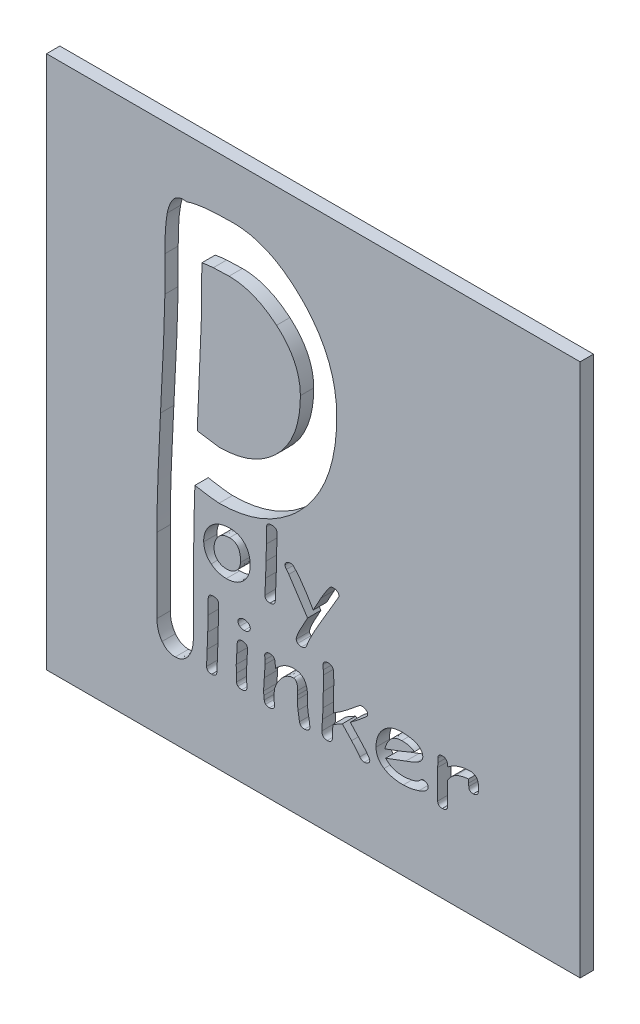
SolidWorks part; units mm, degrees
ref_plane "Front Plane" through (0, 0, 0) normal (0, 0, 1) x (1, 0, 0)
ref_plane "Top Plane" through (0, 0, 0) normal (0, 1, 0) x (1, 0, 0)
ref_plane "Right Plane" through (0, 0, 0) normal (1, 0, 0) x (0, 0, -1)
imported_body "Blank.step"
sketch "Sketch4" plane through (0, 0, 22.1266) normal (0, 0, 1) x (1, 0, 0)
  line L25 (-11.1986, 9.2463) -> (-11.5113, 1.6728)
  line L26 (-2.8189, -5.6212) -> (-2.2368, -4.5509)
  line L27 (-0.0405, -11.5136) -> (0.8168, -12.435)
  line L28 (-14.5347, -12.0279) -> (-14.5347, -6.4334)
  line L29 (6.5117, -13.3502) -> (6.5117, -11.1723)
  line L30 (-5.6686, -10.4712) -> (-5.6568, -10.8342)
  line L31 (4.1166, -11.9572) -> (2.6142, -12.5188)
  line L32 (-11.5113, 1.6728) -> (-9.8731, 1.4255)
  line L33 (-0.9429, -3.8807) -> (-2.3037, -6.2014)
  line L34 (-0.2805, -10.8373) -> (0.5848, -10.133)
  line L35 (-9.9516, -11.0172) -> (-10.0106, -12.5591)
  line L36 (-3.0745, -7.6192) -> (-3.3341, -8.221)
  line L37 (-11.1688, 12.7475) -> (-11.1986, 9.2463)
  line L38 (-3.238, -11.7525) -> (-3.242, -12.041)
  line L39 (-5.5759, -4.2096) -> (-5.6349, -5.7515)
  line L40 (0.0578, -12.6615) -> (-0.6384, -11.9138)
  line L41 (8.8283, -11.0265) -> (8.8165, -10.7659)
  line L42 (2.5473, -11.9479) -> (3.7548, -11.495)
  line L43 (-13.9389, 9.3224) -> (-13.9389, 11.9483)
  line L44 (-4.6516, -4.2127) -> (-4.8286, -3.9862)
  line L45 (-3.8476, -13.3844) -> (-3.9578, -12.7049)
  line L46 (-3.2436, -6.3503) -> (-4.6516, -4.2127)
  line L47 (-3.238, -11.4391) -> (-3.238, -11.7525)
  line L48 (-1.2716, -9.466) -> (-1.2991, -10.465)
  line L49 (7.2393, -11.6501) -> (7.2472, -13.3502)
  spline S194 degree 3 poles (-11.8092, -12.0279) (-11.8092, -12.5353) (-11.9383, -12.9666) (-12.1964, -13.3218) knots 0 0 0 0 1 1 1 1
  spline S195 degree 3 poles (-1.0563, 7.8191) (-1.0563, 4.673) (-1.9896, 2.1676) (-3.8562, 0.3028) knots 0 0 0 0 1 1 1 1
  spline S196 degree 3 poles (-3.7818, 7.8191) (-3.7818, 9.2399) (-4.3775, 10.4641) (-5.5689, 11.4916) knots 0 0 0 0 1 1 1 1
  spline S197 degree 3 poles (-6.331, -3.0896) (-6.3179, -2.6677) (-6.3113, -2.2933) (-6.3113, -1.9665) knots 0 0 0 0 1 1 1 1
  spline S198 degree 3 poles (-10.4275, -13.5891) (-10.6844, -13.5891) (-10.8129, -13.4836) (-10.8129, -13.2727) knots 0 0 0 0 1 1 1 1
  spline S199 degree 3 poles (-9.9122, -8.7741) (-9.9122, -9.1009) (-9.9188, -9.4753) (-9.9319, -9.8972) knots 0 0 0 0 1 1 1 1
  spline S200 degree 3 poles (-7.8081, -12.6056) (-7.7976, -12.8518) (-7.7924, -13.0369) (-7.7924, -13.161) knots 0 0 0 0 1 1 1 1
  spline S201 degree 3 poles (-8.5121, -10.5922) (-8.5121, -10.4991) (-8.4767, -10.4236) (-8.4059, -10.3657) knots 0 0 0 0 1 1 1 1
  spline S202 degree 3 poles (-2.1289, -12.373) (-2.0975, -12.0296) (-2.0817, -11.7721) (-2.0817, -11.6005) knots 0 0 0 0 1 1 1 1
  spline S203 degree 3 poles (-2.066, -10.5239) (-2.0529, -10.1185) (-2.0463, -9.7607) (-2.0463, -9.4505) knots 0 0 0 0 1 1 1 1
  spline S204 degree 3 poles (-1.2912, -9.1309) (-1.2781, -9.2592) (-1.2716, -9.3708) (-1.2716, -9.466) knots 0 0 0 0 1 1 1 1
  spline S205 degree 3 poles (0.8168, -12.435) (1.218, -12.8673) (1.4186, -13.1486) (1.4186, -13.2789) knots 0 0 0 0 1 1 1 1
  spline S206 degree 3 poles (-4.0932, -8.1466) (-4.0932, -7.9397) (-3.81, -7.341) (-3.2436, -6.3503) knots 0 0 0 0 1 1 1 1
  spline S207 degree 3 poles (-10.7067, -9.8972) (-10.6936, -9.4753) (-10.687, -9.1009) (-10.687, -8.7741) knots 0 0 0 0 1 1 1 1
  spline S208 degree 3 poles (-8.4571, -13.3844) (-8.5278, -13.3264) (-8.5632, -13.252) (-8.5632, -13.161) knots 0 0 0 0 1 1 1 1
  spline S209 degree 3 poles (-3.9853, -11.436) (-3.9853, -10.9893) (-4.0902, -10.7659) (-4.2999, -10.7659) knots 0 0 0 0 1 1 1 1
  spline S210 degree 3 poles (-6.3451, -10.1547) (-6.269, -10.0968) (-6.1759, -10.0679) (-6.0658, -10.0679) knots 0 0 0 0 1 1 1 1
  spline S211 degree 3 poles (-1.3895, -13.251) (-1.3895, -13.344) (-1.4263, -13.4195) (-1.4997, -13.4774) knots 0 0 0 0 1 1 1 1
  spline S212 degree 3 poles (0.864, -10.0275) (0.9663, -10.0275) (1.0581, -10.0596) (1.1393, -10.1237) knots 0 0 0 0 1 1 1 1
  spline S213 degree 3 poles (3.8216, -10.7721) (3.5017, -10.7721) (3.2356, -10.8704) (3.0232, -11.0668) knots 0 0 0 0 1 1 1 1
  spline S214 degree 3 poles (9.1783, -11.5508) (8.9528, -11.5508) (8.8401, -11.4484) (8.8401, -11.2437) knots 0 0 0 0 1 1 1 1
  spline S215 degree 3 poles (-9.8731, -2.209) (-10.1511, -2.209) (-10.7568, -2.1266) (-11.6901, -1.9617) knots 0 0 0 0 1 1 1 1
  spline S216 degree 3 poles (-14.2666, 1.4445) (-14.068, 5.1107) (-13.9588, 7.7366) (-13.9389, 9.3224) knots 0 0 0 0 1 1 1 1
  spline S217 degree 3 poles (-11.0269, -5.2954) (-11.0427, -4.828) (-10.8932, -4.4164) (-10.5786, -4.0607) knots 0 0 0 0 1 1 1 1
  spline S218 degree 3 poles (-9.0447, -3.4309) (-8.5204, -3.4309) (-8.1231, -3.6201) (-7.8531, -3.9986) knots 0 0 0 0 1 1 1 1
  spline S219 degree 3 poles (-9.9965, -4.495) (-10.1669, -4.7287) (-10.2522, -4.9955) (-10.2522, -5.2954) knots 0 0 0 0 1 1 1 1
  spline S220 degree 3 poles (-5.6349, -5.7515) (-5.6349, -5.9149) (-5.6454, -6.1548) (-5.6663, -6.4713) knots 0 0 0 0 1 1 1 1
  spline S221 degree 3 poles (-2.3037, -6.2014) (-2.6393, -6.766) (-2.8962, -7.2386) (-3.0745, -7.6192) knots 0 0 0 0 1 1 1 1
  spline S222 degree 3 poles (-10.0106, -12.5591) (-10.0106, -12.7225) (-10.0211, -12.9624) (-10.042, -13.2789) knots 0 0 0 0 1 1 1 1
  spline S223 degree 3 poles (-8.461, -9.1682) (-8.461, -9.0689) (-8.4151, -8.9841) (-8.3233, -8.9138) knots 0 0 0 0 1 1 1 1
  spline S224 degree 3 poles (-7.7413, -10.5922) (-7.7413, -10.7866) (-7.7544, -11.0296) (-7.7806, -11.3212) knots 0 0 0 0 1 1 1 1
  spline S225 degree 3 poles (-3.1594, -12.708) (-3.1017, -12.979) (-3.0728, -13.1992) (-3.0728, -13.3688) knots 0 0 0 0 1 1 1 1
  spline S226 degree 3 poles (-0.6384, -11.9138) (-0.7904, -12.0089) (-1.0264, -12.1424) (-1.3463, -12.314) knots 0 0 0 0 1 1 1 1
  spline S227 degree 3 poles (4.8874, -10.3874) (5.2257, -10.5301) (5.3948, -10.7494) (5.3948, -11.0451) knots 0 0 0 0 1 1 1 1
  spline S228 degree 3 poles (5.4499, -12.5219) (5.5416, -12.5219) (5.6229, -12.5498) (5.6937, -12.6056) knots 0 0 0 0 1 1 1 1
  spline S229 degree 3 poles (7.8214, -11.042) (7.5881, -11.1765) (7.394, -11.3792) (7.2393, -11.6501) knots 0 0 0 0 1 1 1 1
  spline S230 degree 3 poles (6.8775, -10.2447) (7.1345, -10.2447) (7.2643, -10.4164) (7.2669, -10.7597) knots 0 0 0 0 1 1 1 1
  spline S231 degree 3 poles (-14.5347, -6.4334) (-14.5347, -4.5686) (-14.4453, -1.9426) (-14.2666, 1.4445) knots 0 0 0 0 1 1 1 1
  spline S232 degree 3 poles (-9.1284, 12.8998) (-9.5653, 12.8998) (-9.9575, 12.8871) (-10.305, 12.8617) knots 0 0 0 0 1 1 1 1
  spline S233 degree 3 poles (-6.0518, -6.7815) (-6.3087, -6.7815) (-6.4372, -6.676) (-6.4372, -6.4651) knots 0 0 0 0 1 1 1 1
  spline S234 degree 3 poles (-6.4372, -6.4651) (-6.4372, -6.2148) (-6.4228, -5.8394) (-6.3939, -5.3389) knots 0 0 0 0 1 1 1 1
  spline S235 degree 3 poles (-3.9752, -8.3575) (-4.0538, -8.3017) (-4.0932, -8.2314) (-4.0932, -8.1466) knots 0 0 0 0 1 1 1 1
  spline S236 degree 3 poles (-4.9348, -3.7473) (-4.9348, -3.6625) (-4.8942, -3.5881) (-4.8129, -3.524) knots 0 0 0 0 1 1 1 1
  spline S237 degree 3 poles (-7.7806, -11.3212) (-7.8068, -11.6108) (-7.8199, -11.8528) (-7.8199, -12.0472) knots 0 0 0 0 1 1 1 1
  spline S238 degree 3 poles (-3.9578, -12.7049) (-3.9945, -12.4629) (-4.0128, -12.2365) (-4.0128, -12.0255) knots 0 0 0 0 1 1 1 1
  spline S239 degree 3 poles (-6.4866, -11.8487) (-6.4473, -11.4702) (-6.4277, -11.1744) (-6.4277, -10.9614) knots 0 0 0 0 1 1 1 1
  spline S240 degree 3 poles (-2.0463, -9.4505) (-2.0463, -9.3574) (-2.0529, -9.2478) (-2.066, -9.1216) knots 0 0 0 0 1 1 1 1
  spline S241 degree 3 poles (2.6142, -12.5188) (2.761, -12.6904) (2.9433, -12.8197) (3.1609, -12.9066) knots 0 0 0 0 1 1 1 1
  spline S242 degree 3 poles (5.1627, -12.6894) (5.2519, -12.5777) (5.3476, -12.5219) (5.4499, -12.5219) knots 0 0 0 0 1 1 1 1
  spline S243 degree 3 poles (-13.9389, 11.9483) (-13.9389, 13.2042) (-13.8794, 14.1176) (-13.7602, 14.6885) knots 0 0 0 0 1 1 1 1
  spline S244 degree 3 poles (-5.5689, 11.4916) (-6.671, 12.4304) (-7.8575, 12.8998) (-9.1284, 12.8998) knots 0 0 0 0 1 1 1 1
  spline S245 degree 3 poles (-7.9969, -9.528) (-8.1228, -9.528) (-8.2316, -9.4929) (-8.3233, -9.4226) knots 0 0 0 0 1 1 1 1
  spline S246 degree 3 poles (-7.9969, -8.8083) (-7.871, -8.8083) (-7.7635, -8.8434) (-7.6744, -8.9138) knots 0 0 0 0 1 1 1 1
  spline S247 degree 3 poles (-8.5632, -13.161) (-8.5632, -13.0369) (-8.5685, -12.8518) (-8.579, -12.6056) knots 0 0 0 0 1 1 1 1
  spline S248 degree 3 poles (-8.1267, -10.2788) (-8.0139, -10.2788) (-7.9222, -10.3078) (-7.8514, -10.3657) knots 0 0 0 0 1 1 1 1
  spline S249 degree 3 poles (-6.4434, -10.6666) (-6.4513, -10.5363) (-6.4552, -10.4381) (-6.4552, -10.3719) knots 0 0 0 0 1 1 1 1
  spline S250 degree 3 poles (2.3822, -10.8093) (2.7414, -10.4122) (3.2212, -10.2137) (3.8216, -10.2137) knots 0 0 0 0 1 1 1 1
  spline S251 degree 3 poles (5.6937, -12.6056) (5.7671, -12.6594) (5.8038, -12.7225) (5.8038, -12.7949) knots 0 0 0 0 1 1 1 1
  spline S252 degree 3 poles (8.9423, -10.1858) (9.1547, -10.1858) (9.3133, -10.2488) (9.4182, -10.375) knots 0 0 0 0 1 1 1 1
  spline S253 degree 3 poles (9.4182, -10.375) (9.5231, -10.5012) (9.5755, -10.6914) (9.5755, -10.9458) knots 0 0 0 0 1 1 1 1
  spline S254 degree 3 poles (-9.8731, 1.4255) (-8.205, 1.4255) (-6.8001, 1.9646) (-5.6583, 3.0429) knots 0 0 0 0 1 1 1 1
  spline S255 degree 3 poles (-9.3318, -6.8311) (-9.7723, -6.8311) (-10.1512, -6.7029) (-10.4685, -6.4464) knots 0 0 0 0 1 1 1 1
  spline S256 degree 3 poles (-10.2522, -5.2954) (-10.2522, -5.5953) (-10.1486, -5.8291) (-9.9415, -5.9966) knots 0 0 0 0 1 1 1 1
  spline S257 degree 3 poles (-5.9259, -1.6563) (-5.6663, -1.6563) (-5.5366, -1.7597) (-5.5366, -1.9665) knots 0 0 0 0 1 1 1 1
  spline S258 degree 3 poles (-3.6881, -8.4444) (-3.7982, -8.4444) (-3.8939, -8.4155) (-3.9752, -8.3575) knots 0 0 0 0 1 1 1 1
  spline S259 degree 3 poles (-10.7696, -12.1465) (-10.7408, -11.6439) (-10.7264, -11.2675) (-10.7264, -11.0172) knots 0 0 0 0 1 1 1 1
  spline S260 degree 3 poles (-7.8199, -12.0472) (-7.8199, -12.1713) (-7.816, -12.3575) (-7.8081, -12.6056) knots 0 0 0 0 1 1 1 1
  spline S261 degree 3 poles (-5.1416, -11.1785) (-5.3828, -11.4288) (-5.5716, -11.7452) (-5.7079, -12.1279) knots 0 0 0 0 1 1 1 1
  spline S262 degree 3 poles (-2.0817, -11.6005) (-2.0817, -11.2861) (-2.0765, -10.9272) (-2.066, -10.5239) knots 0 0 0 0 1 1 1 1
  spline S263 degree 3 poles (-2.066, -9.1216) (-2.0765, -8.9955) (-2.0817, -8.8858) (-2.0817, -8.7928) knots 0 0 0 0 1 1 1 1
  spline S264 degree 3 poles (-1.3109, -8.7928) (-1.3109, -8.8879) (-1.3043, -9.0006) (-1.2912, -9.1309) knots 0 0 0 0 1 1 1 1
  spline S265 degree 3 poles (-1.3109, -11.5446) (-0.9543, -11.3295) (-0.6108, -11.0937) (-0.2805, -10.8373) knots 0 0 0 0 1 1 1 1
  spline S266 degree 3 poles (9.5755, -10.9458) (9.5755, -11.0534) (9.5742, -11.1258) (9.5716, -11.163) knots 0 0 0 0 1 1 1 1
  spline S267 degree 3 poles (-5.6663, -6.4713) (-5.6926, -6.6781) (-5.821, -6.7815) (-6.0518, -6.7815) knots 0 0 0 0 1 1 1 1
  spline S268 degree 3 poles (-4.8129, -3.524) (-4.729, -3.4598) (-4.6359, -3.4278) (-4.5337, -3.4278) knots 0 0 0 0 1 1 1 1
  spline S269 degree 3 poles (-10.3016, -8.4639) (-10.042, -8.4639) (-9.9122, -8.5673) (-9.9122, -8.7741) knots 0 0 0 0 1 1 1 1
  spline S270 degree 3 poles (-8.5514, -11.3212) (-8.5252, -11.0296) (-8.5121, -10.7866) (-8.5121, -10.5922) knots 0 0 0 0 1 1 1 1
  spline S271 degree 3 poles (-5.8298, -13.5178) (-5.9006, -13.5757) (-5.9924, -13.6046) (-6.1052, -13.6046) knots 0 0 0 0 1 1 1 1
  spline S272 degree 3 poles (-3.0728, -13.3688) (-3.0728, -13.4598) (-3.1109, -13.5333) (-3.1869, -13.5891) knots 0 0 0 0 1 1 1 1
  spline S273 degree 3 poles (1.0096, -13.5829) (0.8653, -13.5829) (0.7539, -13.5229) (0.6753, -13.403) knots 0 0 0 0 1 1 1 1
  spline S274 degree 3 poles (1.4186, -13.2789) (1.4186, -13.3616) (1.3766, -13.433) (1.2927, -13.4929) knots 0 0 0 0 1 1 1 1
  spline S275 degree 3 poles (3.0232, -11.0668) (2.8108, -11.2613) (2.6522, -11.555) (2.5473, -11.9479) knots 0 0 0 0 1 1 1 1
  spline S276 degree 3 poles (6.8578, -13.6636) (6.6271, -13.6636) (6.5117, -13.5591) (6.5117, -13.3502) knots 0 0 0 0 1 1 1 1
  spline S277 degree 3 poles (-13.7602, 14.6885) (-13.5319, 15.8048) (-13.0453, 16.2869) (-12.3007, 16.1346) knots 0 0 0 0 1 1 1 1
  spline S278 degree 3 poles (-8.7859, 16.5152) (-6.9689, 16.5152) (-5.2661, 15.7224) (-3.6775, 14.1366) knots 0 0 0 0 1 1 1 1
  spline S279 degree 3 poles (-6.3939, -5.3389) (-6.3651, -4.8363) (-6.3507, -4.4599) (-6.3507, -4.2096) knots 0 0 0 0 1 1 1 1
  spline S280 degree 3 poles (-10.042, -13.2789) (-10.0683, -13.4857) (-10.1967, -13.5891) (-10.4275, -13.5891) knots 0 0 0 0 1 1 1 1
  spline S281 degree 3 poles (-8.3233, -8.9138) (-8.2316, -8.8434) (-8.1228, -8.8083) (-7.9969, -8.8083) knots 0 0 0 0 1 1 1 1
  spline S282 degree 3 poles (-4.001, -11.7308) (-3.9905, -11.5922) (-3.9853, -11.4939) (-3.9853, -11.436) knots 0 0 0 0 1 1 1 1
  spline S283 degree 3 poles (-2.1722, -13.1424) (-2.1722, -12.9707) (-2.1578, -12.7142) (-2.1289, -12.373) knots 0 0 0 0 1 1 1 1
  spline S284 degree 3 poles (-2.0817, -8.7928) (-2.0817, -8.6997) (-2.0463, -8.6242) (-1.9756, -8.5663) knots 0 0 0 0 1 1 1 1
  spline S285 degree 3 poles (-1.2991, -10.465) (-1.3122, -10.8249) (-1.3161, -11.1847) (-1.3109, -11.5446) knots 0 0 0 0 1 1 1 1
  spline S286 degree 3 poles (4.9504, -11.6098) (4.8193, -11.6842) (4.5413, -11.8001) (4.1166, -11.9572) knots 0 0 0 0 1 1 1 1
  spline S287 degree 3 poles (3.7548, -11.495) (4.2293, -11.313) (4.5676, -11.1547) (4.7695, -11.0203) knots 0 0 0 0 1 1 1 1
  spline S288 degree 3 poles (-11.6901, -1.9617) (-11.7695, -3.8772) (-11.8092, -7.2326) (-11.8092, -12.0279) knots 0 0 0 0 1 1 1 1
  spline S289 degree 3 poles (-4.2544, -3.5364) (-3.8087, -4.0245) (-3.3302, -4.7194) (-2.8189, -5.6212) knots 0 0 0 0 1 1 1 1
  spline S290 degree 3 poles (-2.2368, -4.5509) (-2.0271, -4.1806) (-1.8252, -3.8621) (-1.6311, -3.5953) knots 0 0 0 0 1 1 1 1
  spline S291 degree 3 poles (-8.579, -12.6056) (-8.5868, -12.3575) (-8.5908, -12.1713) (-8.5908, -12.0472) knots 0 0 0 0 1 1 1 1
  spline S292 degree 3 poles (-4.0128, -12.0255) (-4.0128, -11.9676) (-4.0089, -11.8693) (-4.001, -11.7308) knots 0 0 0 0 1 1 1 1
  spline S293 degree 3 poles (-6.5417, -12.7328) (-6.5417, -12.5198) (-6.5234, -12.2251) (-6.4866, -11.8487) knots 0 0 0 0 1 1 1 1
  spline S294 degree 3 poles (-6.4277, -10.9614) (-6.4277, -10.8952) (-6.4329, -10.7969) (-6.4434, -10.6666) knots 0 0 0 0 1 1 1 1
  spline S295 degree 3 poles (3.1609, -12.9066) (3.3811, -12.9935) (3.6368, -13.0369) (3.9278, -13.0369) knots 0 0 0 0 1 1 1 1
  spline S296 degree 3 poles (5.8038, -12.7949) (5.8038, -13.0245) (5.5692, -13.222) (5.0998, -13.3875) knots 0 0 0 0 1 1 1 1
  spline S297 degree 3 poles (6.5196, -10.8652) (6.5275, -10.7287) (6.5314, -10.6263) (6.5314, -10.558) knots 0 0 0 0 1 1 1 1
  spline S298 degree 3 poles (-13.1645, -13.8356) (-13.5616, -13.8356) (-13.8893, -13.6643) (-14.1474, -13.3218) knots 0 0 0 0 1 1 1 1
  spline S299 degree 3 poles (-12.3007, 16.1346) (-11.983, 16.2615) (-11.5312, 16.3567) (-10.9454, 16.4201) knots 0 0 0 0 1 1 1 1
  spline S300 degree 3 poles (-10.4685, -6.4464) (-10.8224, -6.161) (-11.0086, -5.7774) (-11.0269, -5.2954) knots 0 0 0 0 1 1 1 1
  spline S301 degree 3 poles (-7.8531, -3.9986) (-7.6381, -4.3047) (-7.5345, -4.6729) (-7.5424, -5.1031) knots 0 0 0 0 1 1 1 1
  spline S302 degree 3 poles (-7.9986, -6.2789) (-8.3342, -6.6471) (-8.7786, -6.8311) (-9.3318, -6.8311) knots 0 0 0 0 1 1 1 1
  spline S303 degree 3 poles (-8.6279, -5.9687) (-8.405, -5.7949) (-8.287, -5.5602) (-8.2739, -5.2644) knots 0 0 0 0 1 1 1 1
  spline S304 degree 3 poles (-8.2739, -5.2644) (-8.2372, -4.464) (-8.5112, -4.0627) (-9.0959, -4.0607) knots 0 0 0 0 1 1 1 1
  spline S305 degree 3 poles (-9.9319, -9.8972) (-9.945, -10.3171) (-9.9516, -10.6904) (-9.9516, -11.0172) knots 0 0 0 0 1 1 1 1
  spline S306 degree 3 poles (-7.6744, -8.9138) (-7.5826, -8.9841) (-7.5367, -9.0689) (-7.5367, -9.1682) knots 0 0 0 0 1 1 1 1
  spline S307 degree 3 poles (-8.4059, -10.3657) (-8.3325, -10.3078) (-8.2394, -10.2788) (-8.1267, -10.2788) knots 0 0 0 0 1 1 1 1
  spline S308 degree 3 poles (-5.7433, -13.0121) (-5.7276, -13.1362) (-5.7197, -13.2292) (-5.7197, -13.2913) knots 0 0 0 0 1 1 1 1
  spline S309 degree 3 poles (-5.6568, -10.8342) (-5.2163, -10.3709) (-4.764, -10.1392) (-4.2999, -10.1392) knots 0 0 0 0 1 1 1 1
  spline S310 degree 3 poles (-1.9756, -8.5663) (-1.9021, -8.5084) (-1.8091, -8.4794) (-1.6963, -8.4794) knots 0 0 0 0 1 1 1 1
  spline S311 degree 3 poles (-1.6963, -8.4794) (-1.5836, -8.4794) (-1.4918, -8.5084) (-1.421, -8.5663) knots 0 0 0 0 1 1 1 1
  spline S312 degree 3 poles (8.8401, -11.2437) (8.8401, -11.2044) (8.8361, -11.132) (8.8283, -11.0265) knots 0 0 0 0 1 1 1 1
  spline S313 degree 3 poles (8.8165, -10.7659) (8.4022, -10.8052) (8.0705, -10.8972) (7.8214, -11.042) knots 0 0 0 0 1 1 1 1
  spline S314 degree 3 poles (-12.1964, -13.3218) (-12.4546, -13.6643) (-12.7773, -13.8356) (-13.1645, -13.8356) knots 0 0 0 0 1 1 1 1
  spline S315 degree 3 poles (-9.9415, -5.9966) (-9.7684, -6.1352) (-9.5652, -6.2045) (-9.3318, -6.2045) knots 0 0 0 0 1 1 1 1
  spline S316 degree 3 poles (-1.3008, -3.4216) (-1.1933, -3.4216) (-1.0989, -3.4516) (-1.0176, -3.5115) knots 0 0 0 0 1 1 1 1
  spline S317 degree 3 poles (-10.8129, -13.2727) (-10.8129, -13.0224) (-10.7985, -12.647) (-10.7696, -12.1465) knots 0 0 0 0 1 1 1 1
  spline S318 degree 3 poles (-7.7924, -13.161) (-7.7924, -13.252) (-7.8278, -13.3264) (-7.8986, -13.3844) knots 0 0 0 0 1 1 1 1
  spline S319 degree 3 poles (-3.4661, -13.676) (-3.6916, -13.676) (-3.8188, -13.5788) (-3.8476, -13.3844) knots 0 0 0 0 1 1 1 1
  spline S320 degree 3 poles (-6.5181, -13.0121) (-6.5338, -12.888) (-6.5417, -12.7949) (-6.5417, -12.7328) knots 0 0 0 0 1 1 1 1
  spline S321 degree 3 poles (-6.4552, -10.3719) (-6.4552, -10.283) (-6.4185, -10.2106) (-6.3451, -10.1547) knots 0 0 0 0 1 1 1 1
  spline S322 degree 3 poles (1.1511, -10.5549) (0.8286, -10.8528) (0.4314, -11.1723) (-0.0405, -11.5136) knots 0 0 0 0 1 1 1 1
  spline S323 degree 3 poles (1.2927, -13.4929) (1.2114, -13.5529) (1.1171, -13.5829) (1.0096, -13.5829) knots 0 0 0 0 1 1 1 1
  spline S324 degree 3 poles (-9.0959, -4.0607) (-9.4813, -4.0586) (-9.7815, -4.2034) (-9.9965, -4.495) knots 0 0 0 0 1 1 1 1
  spline S325 degree 3 poles (-6.3507, -4.2096) (-6.3507, -3.8828) (-6.3441, -3.5095) (-6.331, -3.0896) knots 0 0 0 0 1 1 1 1
  spline S326 degree 3 poles (-5.5366, -1.9665) (-5.5366, -2.2933) (-5.5431, -2.6677) (-5.5562, -3.0896) knots 0 0 0 0 1 1 1 1
  spline S327 degree 3 poles (-4.5337, -3.4278) (-4.413, -3.4278) (-4.32, -3.464) (-4.2544, -3.5364) knots 0 0 0 0 1 1 1 1
  spline S328 degree 3 poles (-7.8986, -13.3844) (-7.9694, -13.4423) (-8.0624, -13.4712) (-8.1778, -13.4712) knots 0 0 0 0 1 1 1 1
  spline S329 degree 3 poles (-5.7079, -12.1279) (-5.7132, -12.2085) (-5.725, -12.3099) (-5.7433, -12.4319) knots 0 0 0 0 1 1 1 1
  spline S330 degree 3 poles (-6.1052, -13.6046) (-6.2205, -13.6046) (-6.3136, -13.5757) (-6.3844, -13.5178) knots 0 0 0 0 1 1 1 1
  spline S331 degree 3 poles (-6.4906, -13.2913) (-6.4906, -13.2292) (-6.4998, -13.1362) (-6.5181, -13.0121) knots 0 0 0 0 1 1 1 1
  spline S332 degree 3 poles (0.5848, -10.133) (0.6713, -10.0627) (0.7644, -10.0275) (0.864, -10.0275) knots 0 0 0 0 1 1 1 1
  spline S333 degree 3 poles (1.2652, -10.3471) (1.2652, -10.4174) (1.2272, -10.4867) (1.1511, -10.5549) knots 0 0 0 0 1 1 1 1
  spline S334 degree 3 poles (6.5117, -11.1723) (6.5117, -11.1041) (6.5144, -11.0017) (6.5196, -10.8652) knots 0 0 0 0 1 1 1 1
  spline S335 degree 3 poles (-3.6775, 14.1366) (-1.93, 12.386) (-1.0563, 10.2801) (-1.0563, 7.8191) knots 0 0 0 0 1 1 1 1
  spline S336 degree 3 poles (-3.3341, -8.221) (-3.4023, -8.3699) (-3.5203, -8.4444) (-3.6881, -8.4444) knots 0 0 0 0 1 1 1 1
  spline S337 degree 3 poles (-7.6744, -9.4226) (-7.7635, -9.4929) (-7.871, -9.528) (-7.9969, -9.528) knots 0 0 0 0 1 1 1 1
  spline S338 degree 3 poles (-4.2999, -10.7659) (-4.5936, -10.7659) (-4.8741, -10.9034) (-5.1416, -11.1785) knots 0 0 0 0 1 1 1 1
  spline S339 degree 3 poles (-1.4997, -13.4774) (-1.5705, -13.5353) (-1.6622, -13.5643) (-1.775, -13.5643) knots 0 0 0 0 1 1 1 1
  spline S340 degree 3 poles (-1.775, -13.5643) (-2.0398, -13.5643) (-2.1722, -13.4237) (-2.1722, -13.1424) knots 0 0 0 0 1 1 1 1
  spline S341 degree 3 poles (-1.421, -8.5663) (-1.3476, -8.6242) (-1.3109, -8.6997) (-1.3109, -8.7928) knots 0 0 0 0 1 1 1 1
  spline S342 degree 3 poles (1.1393, -10.1237) (1.2232, -10.1878) (1.2652, -10.2623) (1.2652, -10.3471) knots 0 0 0 0 1 1 1 1
  spline S343 degree 3 poles (7.2669, -10.7597) (7.7703, -10.3771) (8.3288, -10.1858) (8.9423, -10.1858) knots 0 0 0 0 1 1 1 1
  spline S344 degree 3 poles (-10.305, 12.8617) (-10.6426, 12.8363) (-10.9305, 12.7983) (-11.1688, 12.7475) knots 0 0 0 0 1 1 1 1
  spline S345 degree 3 poles (-6.3113, -1.9665) (-6.3113, -1.7597) (-6.1829, -1.6563) (-5.9259, -1.6563) knots 0 0 0 0 1 1 1 1
  spline S346 degree 3 poles (-0.8917, -3.7256) (-0.8917, -3.7711) (-0.9088, -3.8228) (-0.9429, -3.8807) knots 0 0 0 0 1 1 1 1
  spline S347 degree 3 poles (-10.687, -8.7741) (-10.687, -8.5673) (-10.5586, -8.4639) (-10.3016, -8.4639) knots 0 0 0 0 1 1 1 1
  spline S348 degree 3 poles (-8.1778, -13.4712) (-8.2906, -13.4712) (-8.3836, -13.4423) (-8.4571, -13.3844) knots 0 0 0 0 1 1 1 1
  spline S349 degree 3 poles (-5.7197, -13.2913) (-5.7197, -13.3844) (-5.7564, -13.4598) (-5.8298, -13.5178) knots 0 0 0 0 1 1 1 1
  spline S350 degree 3 poles (-4.2999, -10.1392) (-3.8804, -10.1392) (-3.5881, -10.285) (-3.4229, -10.5767) knots 0 0 0 0 1 1 1 1
  spline S351 degree 3 poles (-1.3463, -12.314) (-1.3751, -12.6346) (-1.3895, -12.9469) (-1.3895, -13.251) knots 0 0 0 0 1 1 1 1
  spline S352 degree 3 poles (3.9278, -13.5984) (3.3352, -13.5984) (2.8554, -13.4816) (2.4883, -13.2479) knots 0 0 0 0 1 1 1 1
  spline S353 degree 3 poles (5.0998, -13.3875) (4.6987, -13.5281) (4.308, -13.5984) (3.9278, -13.5984) knots 0 0 0 0 1 1 1 1
  spline S354 degree 3 poles (4.7695, -11.0203) (4.544, -10.8548) (4.228, -10.7721) (3.8216, -10.7721) knots 0 0 0 0 1 1 1 1
  spline S355 degree 3 poles (-10.9454, 16.4201) (-10.3596, 16.4835) (-9.6398, 16.5152) (-8.7859, 16.5152) knots 0 0 0 0 1 1 1 1
  spline S356 degree 3 poles (-5.5562, -3.0896) (-5.5693, -3.5095) (-5.5759, -3.8828) (-5.5759, -4.2096) knots 0 0 0 0 1 1 1 1
  spline S357 degree 3 poles (-8.3233, -9.4226) (-8.4151, -9.3522) (-8.461, -9.2674) (-8.461, -9.1682) knots 0 0 0 0 1 1 1 1
  spline S358 degree 3 poles (-7.5367, -9.1682) (-7.5367, -9.2674) (-7.5826, -9.3522) (-7.6744, -9.4226) knots 0 0 0 0 1 1 1 1
  spline S359 degree 3 poles (-8.5908, -12.0472) (-8.5908, -11.8528) (-8.5777, -11.6108) (-8.5514, -11.3212) knots 0 0 0 0 1 1 1 1
  spline S360 degree 3 poles (-3.1869, -13.5891) (-3.2603, -13.647) (-3.3534, -13.676) (-3.4661, -13.676) knots 0 0 0 0 1 1 1 1
  spline S361 degree 3 poles (0.6753, -13.403) (0.5389, -13.1941) (0.3331, -12.9469) (0.0578, -12.6615) knots 0 0 0 0 1 1 1 1
  spline S362 degree 3 poles (2.4883, -13.2479) (2.0872, -12.9893) (1.8866, -12.6274) (1.8866, -12.162) knots 0 0 0 0 1 1 1 1
  spline S363 degree 3 poles (4.5649, -12.9562) (4.8743, -12.888) (5.0736, -12.799) (5.1627, -12.6894) knots 0 0 0 0 1 1 1 1
  spline S364 degree 3 poles (9.5716, -11.163) (9.5532, -11.4216) (9.4221, -11.5508) (9.1783, -11.5508) knots 0 0 0 0 1 1 1 1
  spline S365 degree 3 poles (-14.1474, -13.3218) (-14.4056, -12.9666) (-14.5347, -12.5353) (-14.5347, -12.0279) knots 0 0 0 0 1 1 1 1
  spline S366 degree 3 poles (-3.8562, 0.3028) (-5.5243, -1.3718) (-7.5299, -2.209) (-9.8731, -2.209) knots 0 0 0 0 1 1 1 1
  spline S367 degree 3 poles (-10.5786, -4.0607) (-10.2115, -3.6408) (-9.7002, -3.4309) (-9.0447, -3.4309) knots 0 0 0 0 1 1 1 1
  spline S368 degree 3 poles (-7.5424, -5.1031) (-7.5502, -5.5623) (-7.7023, -5.9542) (-7.9986, -6.2789) knots 0 0 0 0 1 1 1 1
  spline S369 degree 3 poles (-4.8286, -3.9862) (-4.8994, -3.8911) (-4.9348, -3.8114) (-4.9348, -3.7473) knots 0 0 0 0 1 1 1 1
  spline S370 degree 3 poles (-10.7264, -11.0172) (-10.7264, -10.6904) (-10.7198, -10.3171) (-10.7067, -9.8972) knots 0 0 0 0 1 1 1 1
  spline S371 degree 3 poles (-7.8514, -10.3657) (-7.778, -10.4236) (-7.7413, -10.4991) (-7.7413, -10.5922) knots 0 0 0 0 1 1 1 1
  spline S372 degree 3 poles (-5.7669, -12.7328) (-5.7669, -12.7949) (-5.7591, -12.888) (-5.7433, -13.0121) knots 0 0 0 0 1 1 1 1
  spline S373 degree 3 poles (-3.4229, -10.5767) (-3.3101, -10.7711) (-3.2485, -11.0586) (-3.238, -11.4391) knots 0 0 0 0 1 1 1 1
  spline S374 degree 3 poles (-3.242, -12.041) (-3.242, -12.2127) (-3.2144, -12.435) (-3.1594, -12.708) knots 0 0 0 0 1 1 1 1
  spline S375 degree 3 poles (3.8216, -10.2137) (4.2569, -10.2137) (4.6121, -10.2716) (4.8874, -10.3874) knots 0 0 0 0 1 1 1 1
  spline S376 degree 3 poles (5.3948, -11.0451) (5.3948, -11.252) (5.2466, -11.4402) (4.9504, -11.6098) knots 0 0 0 0 1 1 1 1
  spline S377 degree 3 poles (-5.6583, 3.0429) (-4.4073, 4.2227) (-3.7818, 5.8147) (-3.7818, 7.8191) knots 0 0 0 0 1 1 1 1
  spline S378 degree 3 poles (-9.3318, -6.2045) (-9.0592, -6.2045) (-8.8245, -6.1259) (-8.6279, -5.9687) knots 0 0 0 0 1 1 1 1
  spline S379 degree 3 poles (-1.6311, -3.5953) (-1.5472, -3.4795) (-1.4371, -3.4216) (-1.3008, -3.4216) knots 0 0 0 0 1 1 1 1
  spline S380 degree 3 poles (-1.0176, -3.5115) (-0.9337, -3.5715) (-0.8917, -3.6429) (-0.8917, -3.7256) knots 0 0 0 0 1 1 1 1
  spline S381 degree 3 poles (-5.7433, -12.4319) (-5.7591, -12.5353) (-5.7669, -12.6356) (-5.7669, -12.7328) knots 0 0 0 0 1 1 1 1
  spline S382 degree 3 poles (-6.3844, -13.5178) (-6.4552, -13.4598) (-6.4906, -13.3844) (-6.4906, -13.2913) knots 0 0 0 0 1 1 1 1
  spline S383 degree 3 poles (-6.0658, -10.0679) (-5.8246, -10.0679) (-5.6922, -10.2023) (-5.6686, -10.4712) knots 0 0 0 0 1 1 1 1
  spline S384 degree 3 poles (1.8866, -12.162) (1.8866, -11.6242) (2.0518, -11.1734) (2.3822, -10.8093) knots 0 0 0 0 1 1 1 1
  spline S385 degree 3 poles (3.9278, -13.0369) (4.1087, -13.0369) (4.3211, -13.01) (4.5649, -12.9562) knots 0 0 0 0 1 1 1 1
  spline S386 degree 3 poles (7.2472, -13.3502) (7.2472, -13.5591) (7.1174, -13.6636) (6.8578, -13.6636) knots 0 0 0 0 1 1 1 1
  spline S387 degree 3 poles (6.5314, -10.558) (6.5314, -10.3491) (6.6468, -10.2447) (6.8775, -10.2447) knots 0 0 0 0 1 1 1 1
extrude "Cut-Extrude1" cut sketch "Sketch4" against normal through all
